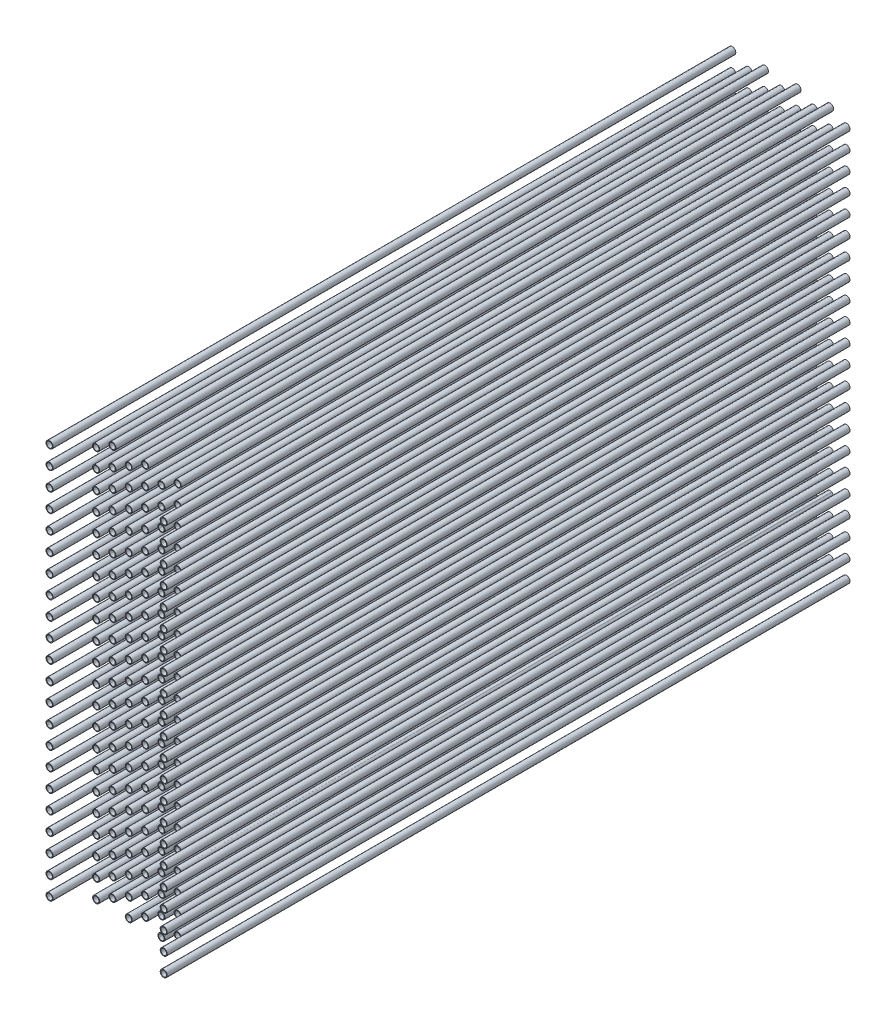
SolidWorks part; units mm, degrees
ref_plane "Alzado" through (0, 0, 0) normal (0, 0, 1) x (1, 0, 0)
ref_plane "Planta" through (0, 0, 0) normal (0, 1, 0) x (1, 0, 0)
ref_plane "Vista lateral" through (0, 0, 0) normal (1, 0, 0) x (0, 0, -1)
sketch "Croquis1" plane through (0, 0, 0) normal (0, 0, 1) x (1, 0, 0)
  line L0 (0, 0) -> (0, -25.4) construction
  line L1 (-22.225, 12.7) -> (-22.225, -12.7) construction
  line L2 (0, 0) -> (-44.45, 0) construction
  line L3 (0, 0) -> (0, -25.4) construction
  line L4 (-22.225, 12.7) -> (-66.675, 12.7) construction
  line L5 (-22.225, 12.7) -> (-22.225, -12.7) construction
  line L6 (-88.9, 0) -> (-88.9, -25.4) construction
  line L7 (-66.675, 12.7) -> (-111.125, 12.7) construction
  line L8 (-88.9, 0) -> (-133.35, 0) construction
  line L9 (-111.125, 12.7) -> (-155.575, 12.7) construction
  line L10 (-155.575, 12.7) -> (-155.575, -12.7) construction
  circle A0 centre (0, 0) radius 4.7625
  circle A1 centre (0, 0) radius 3.8625
  circle A2 centre (0, -25.4) radius 4.7625
  circle A3 centre (0, -25.4) radius 3.8625
  circle A4 centre (0, -50.8) radius 4.7625
  circle A5 centre (0, -50.8) radius 3.8625
  circle A6 centre (0, -76.2) radius 4.7625
  circle A7 centre (0, -76.2) radius 3.8625
  circle A8 centre (0, -101.6) radius 4.7625
  circle A9 centre (0, -101.6) radius 3.8625
  circle A10 centre (0, -127) radius 4.7625
  circle A11 centre (0, -127) radius 3.8625
  circle A12 centre (0, -152.4) radius 4.7625
  circle A13 centre (0, -152.4) radius 3.8625
  circle A14 centre (0, -177.8) radius 4.7625
  circle A15 centre (0, -177.8) radius 3.8625
  circle A16 centre (0, -203.2) radius 4.7625
  circle A17 centre (0, -203.2) radius 3.8625
  circle A18 centre (0, -228.6) radius 4.7625
  circle A19 centre (0, -228.6) radius 3.8625
  circle A20 centre (0, -254) radius 4.7625
  circle A21 centre (0, -254) radius 3.8625
  circle A22 centre (0, -279.4) radius 4.7625
  circle A23 centre (0, -279.4) radius 3.8625
  circle A24 centre (0, -304.8) radius 4.7625
  circle A25 centre (0, -304.8) radius 3.8625
  circle A26 centre (0, -330.2) radius 4.7625
  circle A27 centre (0, -330.2) radius 3.8625
  circle A28 centre (0, -355.6) radius 4.7625
  circle A29 centre (0, -355.6) radius 3.8625
  circle A30 centre (0, -381) radius 4.7625
  circle A31 centre (0, -381) radius 3.8625
  circle A32 centre (0, -406.4) radius 4.7625
  circle A33 centre (0, -406.4) radius 3.8625
  circle A34 centre (0, -431.8) radius 4.7625
  circle A35 centre (0, -431.8) radius 3.8625
  circle A36 centre (0, -457.2) radius 4.7625
  circle A37 centre (0, -457.2) radius 3.8625
  circle A38 centre (0, -482.6) radius 4.7625
  circle A39 centre (0, -482.6) radius 3.8625
  circle A40 centre (0, -508) radius 4.7625
  circle A41 centre (0, -508) radius 3.8625
  circle A42 centre (0, -533.4) radius 4.7625
  circle A43 centre (0, -533.4) radius 3.8625
  circle A44 centre (-22.225, 12.7) radius 4.7625
  circle A45 centre (-22.225, 12.7) radius 3.8625
  circle A46 centre (-22.225, -12.7) radius 4.7625
  circle A47 centre (-22.225, -12.7) radius 3.8625
  circle A48 centre (-22.225, -38.1) radius 4.7625
  circle A49 centre (-22.225, -38.1) radius 3.8625
  circle A50 centre (-22.225, -63.5) radius 4.7625
  circle A51 centre (-22.225, -63.5) radius 3.8625
  circle A52 centre (-22.225, -88.9) radius 4.7625
  circle A53 centre (-22.225, -88.9) radius 3.8625
  circle A54 centre (-22.225, -114.3) radius 4.7625
  circle A55 centre (-22.225, -114.3) radius 3.8625
  circle A56 centre (-22.225, -139.7) radius 4.7625
  circle A57 centre (-22.225, -139.7) radius 3.8625
  circle A58 centre (-22.225, -165.1) radius 4.7625
  circle A59 centre (-22.225, -165.1) radius 3.8625
  circle A60 centre (-22.225, -190.5) radius 4.7625
  circle A61 centre (-22.225, -190.5) radius 3.8625
  circle A62 centre (-22.225, -215.9) radius 4.7625
  circle A63 centre (-22.225, -215.9) radius 3.8625
  circle A64 centre (-22.225, -241.3) radius 4.7625
  circle A65 centre (-22.225, -241.3) radius 3.8625
  circle A66 centre (-22.225, -266.7) radius 4.7625
  circle A67 centre (-22.225, -266.7) radius 3.8625
  circle A68 centre (-22.225, -292.1) radius 4.7625
  circle A69 centre (-22.225, -292.1) radius 3.8625
  circle A70 centre (-22.225, -317.5) radius 4.7625
  circle A71 centre (-22.225, -317.5) radius 3.8625
  circle A72 centre (-22.225, -342.9) radius 4.7625
  circle A73 centre (-22.225, -342.9) radius 3.8625
  circle A74 centre (-22.225, -368.3) radius 4.7625
  circle A75 centre (-22.225, -368.3) radius 3.8625
  circle A76 centre (-22.225, -393.7) radius 4.7625
  circle A77 centre (-22.225, -393.7) radius 3.8625
  circle A78 centre (-22.225, -419.1) radius 4.7625
  circle A79 centre (-22.225, -419.1) radius 3.8625
  circle A80 centre (-22.225, -444.5) radius 4.7625
  circle A81 centre (-22.225, -444.5) radius 3.8625
  circle A82 centre (-22.225, -469.9) radius 4.7625
  circle A83 centre (-22.225, -469.9) radius 3.8625
  circle A84 centre (-22.225, -495.3) radius 4.7625
  circle A85 centre (-22.225, -495.3) radius 3.8625
  circle A86 centre (-22.225, -520.7) radius 4.7625
  circle A87 centre (-22.225, -520.7) radius 3.8625
  circle A88 centre (-44.45, 0) radius 4.7625
  circle A89 centre (-44.45, 0) radius 3.8625
  circle A90 centre (0, -25.4) radius 4.7625
  circle A91 centre (0, -25.4) radius 3.8625
  circle A92 centre (-44.45, -25.4) radius 4.7625
  circle A93 centre (-44.45, -25.4) radius 3.8625
  circle A94 centre (0, -50.8) radius 4.7625
  circle A95 centre (0, -50.8) radius 3.8625
  circle A96 centre (-44.45, -50.8) radius 4.7625
  circle A97 centre (-44.45, -50.8) radius 3.8625
  circle A98 centre (0, -76.2) radius 4.7625
  circle A99 centre (0, -76.2) radius 3.8625
  circle A100 centre (-44.45, -76.2) radius 4.7625
  circle A101 centre (-44.45, -76.2) radius 3.8625
  circle A102 centre (0, -101.6) radius 4.7625
  circle A103 centre (0, -101.6) radius 3.8625
  circle A104 centre (-44.45, -101.6) radius 4.7625
  circle A105 centre (-44.45, -101.6) radius 3.8625
  circle A106 centre (0, -127) radius 4.7625
  circle A107 centre (0, -127) radius 3.8625
  circle A108 centre (-44.45, -127) radius 4.7625
  circle A109 centre (-44.45, -127) radius 3.8625
  circle A110 centre (0, -152.4) radius 4.7625
  circle A111 centre (0, -152.4) radius 3.8625
  circle A112 centre (-44.45, -152.4) radius 4.7625
  circle A113 centre (-44.45, -152.4) radius 3.8625
  circle A114 centre (0, -177.8) radius 4.7625
  circle A115 centre (0, -177.8) radius 3.8625
  circle A116 centre (-44.45, -177.8) radius 4.7625
  circle A117 centre (-44.45, -177.8) radius 3.8625
  circle A118 centre (0, -203.2) radius 4.7625
  circle A119 centre (0, -203.2) radius 3.8625
  circle A120 centre (-44.45, -203.2) radius 4.7625
  circle A121 centre (-44.45, -203.2) radius 3.8625
  circle A122 centre (0, -228.6) radius 4.7625
  circle A123 centre (0, -228.6) radius 3.8625
  circle A124 centre (-44.45, -228.6) radius 4.7625
  circle A125 centre (-44.45, -228.6) radius 3.8625
  circle A126 centre (0, -254) radius 4.7625
  circle A127 centre (0, -254) radius 3.8625
  circle A128 centre (-44.45, -254) radius 4.7625
  circle A129 centre (-44.45, -254) radius 3.8625
  circle A130 centre (0, -279.4) radius 4.7625
  circle A131 centre (0, -279.4) radius 3.8625
  circle A132 centre (-44.45, -279.4) radius 4.7625
  circle A133 centre (-44.45, -279.4) radius 3.8625
  circle A134 centre (0, -304.8) radius 4.7625
  circle A135 centre (0, -304.8) radius 3.8625
  circle A136 centre (-44.45, -304.8) radius 4.7625
  circle A137 centre (-44.45, -304.8) radius 3.8625
  circle A138 centre (0, -330.2) radius 4.7625
  circle A139 centre (0, -330.2) radius 3.8625
  circle A140 centre (-44.45, -330.2) radius 4.7625
  circle A141 centre (-44.45, -330.2) radius 3.8625
  circle A142 centre (0, -355.6) radius 4.7625
  circle A143 centre (0, -355.6) radius 3.8625
  circle A144 centre (-44.45, -355.6) radius 4.7625
  circle A145 centre (-44.45, -355.6) radius 3.8625
  circle A146 centre (0, -381) radius 4.7625
  circle A147 centre (0, -381) radius 3.8625
  circle A148 centre (-44.45, -381) radius 4.7625
  circle A149 centre (-44.45, -381) radius 3.8625
  circle A150 centre (0, -406.4) radius 4.7625
  circle A151 centre (0, -406.4) radius 3.8625
  circle A152 centre (-44.45, -406.4) radius 4.7625
  circle A153 centre (-44.45, -406.4) radius 3.8625
  circle A154 centre (0, -431.8) radius 4.7625
  circle A155 centre (0, -431.8) radius 3.8625
  circle A156 centre (-44.45, -431.8) radius 4.7625
  circle A157 centre (-44.45, -431.8) radius 3.8625
  circle A158 centre (0, -457.2) radius 4.7625
  circle A159 centre (0, -457.2) radius 3.8625
  circle A160 centre (-44.45, -457.2) radius 4.7625
  circle A161 centre (-44.45, -457.2) radius 3.8625
  circle A162 centre (0, -482.6) radius 4.7625
  circle A163 centre (0, -482.6) radius 3.8625
  circle A164 centre (-44.45, -482.6) radius 4.7625
  circle A165 centre (-44.45, -482.6) radius 3.8625
  circle A166 centre (0, -508) radius 4.7625
  circle A167 centre (0, -508) radius 3.8625
  circle A168 centre (-44.45, -508) radius 4.7625
  circle A169 centre (-44.45, -508) radius 3.8625
  circle A170 centre (0, -533.4) radius 4.7625
  circle A171 centre (0, -533.4) radius 3.8625
  circle A172 centre (-44.45, -533.4) radius 4.7625
  circle A173 centre (-44.45, -533.4) radius 3.8625
  circle A174 centre (-66.675, 12.7) radius 4.7625
  circle A175 centre (-66.675, 12.7) radius 3.8625
  circle A176 centre (-22.225, -12.7) radius 4.7625
  circle A177 centre (-22.225, -12.7) radius 3.8625
  circle A178 centre (-66.675, -12.7) radius 4.7625
  circle A179 centre (-66.675, -12.7) radius 3.8625
  circle A180 centre (-22.225, -38.1) radius 4.7625
  circle A181 centre (-22.225, -38.1) radius 3.8625
  circle A182 centre (-66.675, -38.1) radius 4.7625
  circle A183 centre (-66.675, -38.1) radius 3.8625
  circle A184 centre (-22.225, -63.5) radius 4.7625
  circle A185 centre (-22.225, -63.5) radius 3.8625
  circle A186 centre (-66.675, -63.5) radius 4.7625
  circle A187 centre (-66.675, -63.5) radius 3.8625
  circle A188 centre (-22.225, -88.9) radius 4.7625
  circle A189 centre (-22.225, -88.9) radius 3.8625
  circle A190 centre (-66.675, -88.9) radius 4.7625
  circle A191 centre (-66.675, -88.9) radius 3.8625
  circle A192 centre (-22.225, -114.3) radius 4.7625
  circle A193 centre (-22.225, -114.3) radius 3.8625
  circle A194 centre (-66.675, -114.3) radius 4.7625
  circle A195 centre (-66.675, -114.3) radius 3.8625
  circle A196 centre (-22.225, -139.7) radius 4.7625
  circle A197 centre (-22.225, -139.7) radius 3.8625
  circle A198 centre (-66.675, -139.7) radius 4.7625
  circle A199 centre (-66.675, -139.7) radius 3.8625
  circle A200 centre (-22.225, -165.1) radius 4.7625
  circle A201 centre (-22.225, -165.1) radius 3.8625
  circle A202 centre (-66.675, -165.1) radius 4.7625
  circle A203 centre (-66.675, -165.1) radius 3.8625
  circle A204 centre (-22.225, -190.5) radius 4.7625
  circle A205 centre (-22.225, -190.5) radius 3.8625
  circle A206 centre (-66.675, -190.5) radius 4.7625
  circle A207 centre (-66.675, -190.5) radius 3.8625
  circle A208 centre (-22.225, -215.9) radius 4.7625
  circle A209 centre (-22.225, -215.9) radius 3.8625
  circle A210 centre (-66.675, -215.9) radius 4.7625
  circle A211 centre (-66.675, -215.9) radius 3.8625
  circle A212 centre (-22.225, -241.3) radius 4.7625
  circle A213 centre (-22.225, -241.3) radius 3.8625
  circle A214 centre (-66.675, -241.3) radius 4.7625
  circle A215 centre (-66.675, -241.3) radius 3.8625
  circle A216 centre (-22.225, -266.7) radius 4.7625
  circle A217 centre (-22.225, -266.7) radius 3.8625
  circle A218 centre (-66.675, -266.7) radius 4.7625
  circle A219 centre (-66.675, -266.7) radius 3.8625
  circle A220 centre (-22.225, -292.1) radius 4.7625
  circle A221 centre (-22.225, -292.1) radius 3.8625
  circle A222 centre (-66.675, -292.1) radius 4.7625
  circle A223 centre (-66.675, -292.1) radius 3.8625
  circle A224 centre (-22.225, -317.5) radius 4.7625
  circle A225 centre (-22.225, -317.5) radius 3.8625
  circle A226 centre (-66.675, -317.5) radius 4.7625
  circle A227 centre (-66.675, -317.5) radius 3.8625
  circle A228 centre (-22.225, -342.9) radius 4.7625
  circle A229 centre (-22.225, -342.9) radius 3.8625
  circle A230 centre (-66.675, -342.9) radius 4.7625
  circle A231 centre (-66.675, -342.9) radius 3.8625
  circle A232 centre (-22.225, -368.3) radius 4.7625
  circle A233 centre (-22.225, -368.3) radius 3.8625
  circle A234 centre (-66.675, -368.3) radius 4.7625
  circle A235 centre (-66.675, -368.3) radius 3.8625
  circle A236 centre (-22.225, -393.7) radius 4.7625
  circle A237 centre (-22.225, -393.7) radius 3.8625
  circle A238 centre (-66.675, -393.7) radius 4.7625
  circle A239 centre (-66.675, -393.7) radius 3.8625
  circle A240 centre (-22.225, -419.1) radius 4.7625
  circle A241 centre (-22.225, -419.1) radius 3.8625
  circle A242 centre (-66.675, -419.1) radius 4.7625
  circle A243 centre (-66.675, -419.1) radius 3.8625
  circle A244 centre (-22.225, -444.5) radius 4.7625
  circle A245 centre (-22.225, -444.5) radius 3.8625
  circle A246 centre (-66.675, -444.5) radius 4.7625
  circle A247 centre (-66.675, -444.5) radius 3.8625
  circle A248 centre (-22.225, -469.9) radius 4.7625
  circle A249 centre (-22.225, -469.9) radius 3.8625
  circle A250 centre (-66.675, -469.9) radius 4.7625
  circle A251 centre (-66.675, -469.9) radius 3.8625
  circle A252 centre (-22.225, -495.3) radius 4.7625
  circle A253 centre (-22.225, -495.3) radius 3.8625
  circle A254 centre (-66.675, -495.3) radius 4.7625
  circle A255 centre (-66.675, -495.3) radius 3.8625
  circle A256 centre (-22.225, -520.7) radius 4.7625
  circle A257 centre (-22.225, -520.7) radius 3.8625
  circle A258 centre (-66.675, -520.7) radius 4.7625
  circle A259 centre (-66.675, -520.7) radius 3.8625
  circle A260 centre (-88.9, 0) radius 4.7625
  circle A261 centre (-88.9, 0) radius 3.8625
  circle A262 centre (-88.9, -25.4) radius 4.7625
  circle A263 centre (-88.9, -25.4) radius 3.8625
  circle A264 centre (-88.9, -50.8) radius 4.7625
  circle A265 centre (-88.9, -50.8) radius 3.8625
  circle A266 centre (-88.9, -76.2) radius 4.7625
  circle A267 centre (-88.9, -76.2) radius 3.8625
  circle A268 centre (-88.9, -101.6) radius 4.7625
  circle A269 centre (-88.9, -101.6) radius 3.8625
  circle A270 centre (-88.9, -127) radius 4.7625
  circle A271 centre (-88.9, -127) radius 3.8625
  circle A272 centre (-88.9, -152.4) radius 4.7625
  circle A273 centre (-88.9, -152.4) radius 3.8625
  circle A274 centre (-88.9, -177.8) radius 4.7625
  circle A275 centre (-88.9, -177.8) radius 3.8625
  circle A276 centre (-88.9, -203.2) radius 4.7625
  circle A277 centre (-88.9, -203.2) radius 3.8625
  circle A278 centre (-88.9, -228.6) radius 4.7625
  circle A279 centre (-88.9, -228.6) radius 3.8625
  circle A280 centre (-88.9, -254) radius 4.7625
  circle A281 centre (-88.9, -254) radius 3.8625
  circle A282 centre (-88.9, -279.4) radius 4.7625
  circle A283 centre (-88.9, -279.4) radius 3.8625
  circle A284 centre (-88.9, -304.8) radius 4.7625
  circle A285 centre (-88.9, -304.8) radius 3.8625
  circle A286 centre (-88.9, -330.2) radius 4.7625
  circle A287 centre (-88.9, -330.2) radius 3.8625
  circle A288 centre (-88.9, -355.6) radius 4.7625
  circle A289 centre (-88.9, -355.6) radius 3.8625
  circle A290 centre (-88.9, -381) radius 4.7625
  circle A291 centre (-88.9, -381) radius 3.8625
  circle A292 centre (-88.9, -406.4) radius 4.7625
  circle A293 centre (-88.9, -406.4) radius 3.8625
  circle A294 centre (-88.9, -431.8) radius 4.7625
  circle A295 centre (-88.9, -431.8) radius 3.8625
  circle A296 centre (-88.9, -457.2) radius 4.7625
  circle A297 centre (-88.9, -457.2) radius 3.8625
  circle A298 centre (-88.9, -482.6) radius 4.7625
  circle A299 centre (-88.9, -482.6) radius 3.8625
  circle A300 centre (-88.9, -508) radius 4.7625
  circle A301 centre (-88.9, -508) radius 3.8625
  circle A302 centre (-88.9, -533.4) radius 4.7625
  circle A303 centre (-88.9, -533.4) radius 3.8625
  circle A304 centre (-111.125, 12.7) radius 4.7625
  circle A305 centre (-111.125, 12.7) radius 3.8625
  circle A306 centre (-111.125, -12.7) radius 4.7625
  circle A307 centre (-111.125, -12.7) radius 3.8625
  circle A308 centre (-111.125, -38.1) radius 4.7625
  circle A309 centre (-111.125, -38.1) radius 3.8625
  circle A310 centre (-111.125, -63.5) radius 4.7625
  circle A311 centre (-111.125, -63.5) radius 3.8625
  circle A312 centre (-111.125, -88.9) radius 4.7625
  circle A313 centre (-111.125, -88.9) radius 3.8625
  circle A314 centre (-111.125, -114.3) radius 4.7625
  circle A315 centre (-111.125, -114.3) radius 3.8625
  circle A316 centre (-111.125, -139.7) radius 4.7625
  circle A317 centre (-111.125, -139.7) radius 3.8625
  circle A318 centre (-111.125, -165.1) radius 4.7625
  circle A319 centre (-111.125, -165.1) radius 3.8625
  circle A320 centre (-111.125, -190.5) radius 4.7625
  circle A321 centre (-111.125, -190.5) radius 3.8625
  circle A322 centre (-111.125, -215.9) radius 4.7625
  circle A323 centre (-111.125, -215.9) radius 3.8625
  circle A324 centre (-111.125, -241.3) radius 4.7625
  circle A325 centre (-111.125, -241.3) radius 3.8625
  circle A326 centre (-111.125, -266.7) radius 4.7625
  circle A327 centre (-111.125, -266.7) radius 3.8625
  circle A328 centre (-111.125, -292.1) radius 4.7625
  circle A329 centre (-111.125, -292.1) radius 3.8625
  circle A330 centre (-111.125, -317.5) radius 4.7625
  circle A331 centre (-111.125, -317.5) radius 3.8625
  circle A332 centre (-111.125, -342.9) radius 4.7625
  circle A333 centre (-111.125, -342.9) radius 3.8625
  circle A334 centre (-111.125, -368.3) radius 4.7625
  circle A335 centre (-111.125, -368.3) radius 3.8625
  circle A336 centre (-111.125, -393.7) radius 4.7625
  circle A337 centre (-111.125, -393.7) radius 3.8625
  circle A338 centre (-111.125, -419.1) radius 4.7625
  circle A339 centre (-111.125, -419.1) radius 3.8625
  circle A340 centre (-111.125, -444.5) radius 4.7625
  circle A341 centre (-111.125, -444.5) radius 3.8625
  circle A342 centre (-111.125, -469.9) radius 4.7625
  circle A343 centre (-111.125, -469.9) radius 3.8625
  circle A344 centre (-111.125, -495.3) radius 4.7625
  circle A345 centre (-111.125, -495.3) radius 3.8625
  circle A346 centre (-111.125, -520.7) radius 4.7625
  circle A347 centre (-111.125, -520.7) radius 3.8625
  circle A348 centre (-133.35, 0) radius 4.7625
  circle A349 centre (-133.35, 0) radius 3.8625
  circle A350 centre (-133.35, -25.4) radius 4.7625
  circle A351 centre (-133.35, -25.4) radius 3.8625
  circle A352 centre (-133.35, -50.8) radius 4.7625
  circle A353 centre (-133.35, -50.8) radius 3.8625
  circle A354 centre (-133.35, -76.2) radius 4.7625
  circle A355 centre (-133.35, -76.2) radius 3.8625
  circle A356 centre (-133.35, -101.6) radius 4.7625
  circle A357 centre (-133.35, -101.6) radius 3.8625
  circle A358 centre (-133.35, -127) radius 4.7625
  circle A359 centre (-133.35, -127) radius 3.8625
  circle A360 centre (-133.35, -152.4) radius 4.7625
  circle A361 centre (-133.35, -152.4) radius 3.8625
  circle A362 centre (-133.35, -177.8) radius 4.7625
  circle A363 centre (-133.35, -177.8) radius 3.8625
  circle A364 centre (-133.35, -203.2) radius 4.7625
  circle A365 centre (-133.35, -203.2) radius 3.8625
  circle A366 centre (-133.35, -228.6) radius 4.7625
  circle A367 centre (-133.35, -228.6) radius 3.8625
  circle A368 centre (-133.35, -254) radius 4.7625
  circle A369 centre (-133.35, -254) radius 3.8625
  circle A370 centre (-133.35, -279.4) radius 4.7625
  circle A371 centre (-133.35, -279.4) radius 3.8625
  circle A372 centre (-133.35, -304.8) radius 4.7625
  circle A373 centre (-133.35, -304.8) radius 3.8625
  circle A374 centre (-133.35, -330.2) radius 4.7625
  circle A375 centre (-133.35, -330.2) radius 3.8625
  circle A376 centre (-133.35, -355.6) radius 4.7625
  circle A377 centre (-133.35, -355.6) radius 3.8625
  circle A378 centre (-133.35, -381) radius 4.7625
  circle A379 centre (-133.35, -381) radius 3.8625
  circle A380 centre (-133.35, -406.4) radius 4.7625
  circle A381 centre (-133.35, -406.4) radius 3.8625
  circle A382 centre (-133.35, -431.8) radius 4.7625
  circle A383 centre (-133.35, -431.8) radius 3.8625
  circle A384 centre (-133.35, -457.2) radius 4.7625
  circle A385 centre (-133.35, -457.2) radius 3.8625
  circle A386 centre (-133.35, -482.6) radius 4.7625
  circle A387 centre (-133.35, -482.6) radius 3.8625
  circle A388 centre (-133.35, -508) radius 4.7625
  circle A389 centre (-133.35, -508) radius 3.8625
  circle A390 centre (-133.35, -533.4) radius 4.7625
  circle A391 centre (-133.35, -533.4) radius 3.8625
  circle A392 centre (-155.575, 12.7) radius 4.7625
  circle A393 centre (-155.575, 12.7) radius 3.8625
  circle A394 centre (-155.575, -12.7) radius 4.7625
  circle A395 centre (-155.575, -12.7) radius 3.8625
  circle A396 centre (-155.575, -38.1) radius 4.7625
  circle A397 centre (-155.575, -38.1) radius 3.8625
  circle A398 centre (-155.575, -63.5) radius 4.7625
  circle A399 centre (-155.575, -63.5) radius 3.8625
  circle A400 centre (-155.575, -88.9) radius 4.7625
  circle A401 centre (-155.575, -88.9) radius 3.8625
  circle A402 centre (-155.575, -114.3) radius 4.7625
  circle A403 centre (-155.575, -114.3) radius 3.8625
  circle A404 centre (-155.575, -139.7) radius 4.7625
  circle A405 centre (-155.575, -139.7) radius 3.8625
  circle A406 centre (-155.575, -165.1) radius 4.7625
  circle A407 centre (-155.575, -165.1) radius 3.8625
  circle A408 centre (-155.575, -190.5) radius 4.7625
  circle A409 centre (-155.575, -190.5) radius 3.8625
  circle A410 centre (-155.575, -215.9) radius 4.7625
  circle A411 centre (-155.575, -215.9) radius 3.8625
  circle A412 centre (-155.575, -241.3) radius 4.7625
  circle A413 centre (-155.575, -241.3) radius 3.8625
  circle A414 centre (-155.575, -266.7) radius 4.7625
  circle A415 centre (-155.575, -266.7) radius 3.8625
  circle A416 centre (-155.575, -292.1) radius 4.7625
  circle A417 centre (-155.575, -292.1) radius 3.8625
  circle A418 centre (-155.575, -317.5) radius 4.7625
  circle A419 centre (-155.575, -317.5) radius 3.8625
  circle A420 centre (-155.575, -342.9) radius 4.7625
  circle A421 centre (-155.575, -342.9) radius 3.8625
  circle A422 centre (-155.575, -368.3) radius 4.7625
  circle A423 centre (-155.575, -368.3) radius 3.8625
  circle A424 centre (-155.575, -393.7) radius 4.7625
  circle A425 centre (-155.575, -393.7) radius 3.8625
  circle A426 centre (-155.575, -419.1) radius 4.7625
  circle A427 centre (-155.575, -419.1) radius 3.8625
  circle A428 centre (-155.575, -444.5) radius 4.7625
  circle A429 centre (-155.575, -444.5) radius 3.8625
  circle A430 centre (-155.575, -469.9) radius 4.7625
  circle A431 centre (-155.575, -469.9) radius 3.8625
  circle A432 centre (-155.575, -495.3) radius 4.7625
  circle A433 centre (-155.575, -495.3) radius 3.8625
  circle A434 centre (-155.575, -520.7) radius 4.7625
  circle A435 centre (-155.575, -520.7) radius 3.8625
  dimension "D1" = 9.525
  dimension "D2" = 7.725
  dimension "D7" = 9.525
  dimension "D8" = 7.725
  dimension "D4" = 25.4
  dimension "D5" = 12.7
  dimension "D6" = 22.225
  dimension "D10" = 25.4
  dimension "D12" = 44.45
  dimension "D14" = 25.4
  dimension "D16" = 44.45
  dimension "D18" = 25.4
  dimension "D21" = 25.4
  dimension "D23" = 44.45
  dimension "D26" = 44.45
  dimension "D29" = 44.45
  dimension "D31" = 25.4
  dimension "D3" = 22
  dimension "D9" = 22
  dimension "D11" = 2
  dimension "D13" = 22
  dimension "D15" = 2
  dimension "D17" = 22
  dimension "D19" = 2
  dimension "D20" = 22
  dimension "D22" = 2
  dimension "D24" = 22
  dimension "D25" = 2
  dimension "D27" = 22
  dimension "D28" = 2
  dimension "D30" = 22
extrude "Saliente-Extruir1" add sketch "Croquis1" against normal blind 889
sketch "Croquis2" plane through (0, 0, 0) normal (0, 0, 1) x (1, 0, 0)
  circle A0 centre (-155.575, -520.7) radius 3.8625 construction
  circle A1 centre (-155.575, -520.7) radius 4.7625 construction
  circle A2 centre (-155.575, -520.7) radius 3.8625
  circle A3 centre (-155.575, -520.7) radius 4.7625
extrude "Saliente-Extruir2" add sketch "Croquis2" along normal blind 41.275
sketch "Croquis3" plane through (0, 0, 0) normal (0, 0, 1) x (1, 0, 0)
  circle A0 centre (-155.575, -495.3) radius 3.8625 construction
  circle A1 centre (-155.575, -495.3) radius 4.7625 construction
  circle A2 centre (-155.575, -469.9) radius 3.8625 construction
  circle A3 centre (-155.575, -469.9) radius 4.7625 construction
  circle A4 centre (-155.575, -444.5) radius 3.8625 construction
  circle A5 centre (-155.575, -444.5) radius 4.7625 construction
  circle A6 centre (-155.575, -419.1) radius 3.8625 construction
  circle A7 centre (-155.575, -419.1) radius 4.7625 construction
  circle A8 centre (-155.575, -393.7) radius 3.8625 construction
  circle A9 centre (-155.575, -393.7) radius 4.7625 construction
  circle A10 centre (-155.575, -368.3) radius 3.8625 construction
  circle A11 centre (-155.575, -368.3) radius 4.7625 construction
  circle A12 centre (-155.575, -342.9) radius 3.8625 construction
  circle A13 centre (-155.575, -342.9) radius 4.7625 construction
  circle A14 centre (-155.575, -317.5) radius 3.8625 construction
  circle A15 centre (-155.575, -317.5) radius 4.7625 construction
  circle A16 centre (-155.575, -292.1) radius 3.8625 construction
  circle A17 centre (-155.575, -292.1) radius 4.7625 construction
  circle A18 centre (-155.575, -266.7) radius 3.8625 construction
  circle A19 centre (-155.575, -266.7) radius 4.7625 construction
  circle A20 centre (-155.575, -241.3) radius 3.8625 construction
  circle A21 centre (-155.575, -241.3) radius 4.7625 construction
  circle A22 centre (-155.575, -215.9) radius 3.8625 construction
  circle A23 centre (-155.575, -215.9) radius 4.7625 construction
  circle A24 centre (-155.575, -190.5) radius 3.8625 construction
  circle A25 centre (-155.575, -190.5) radius 4.7625 construction
  circle A26 centre (-155.575, -165.1) radius 3.8625 construction
  circle A27 centre (-155.575, -165.1) radius 4.7625 construction
  circle A28 centre (-155.575, -139.7) radius 3.8625 construction
  circle A29 centre (-155.575, -139.7) radius 4.7625 construction
  circle A30 centre (-155.575, -114.3) radius 3.8625 construction
  circle A31 centre (-155.575, -114.3) radius 4.7625 construction
  circle A32 centre (-155.575, -88.9) radius 3.8625 construction
  circle A33 centre (-155.575, -88.9) radius 4.7625 construction
  circle A34 centre (-155.575, -63.5) radius 3.8625 construction
  circle A35 centre (-155.575, -63.5) radius 4.7625 construction
  circle A36 centre (-155.575, -38.1) radius 3.8625 construction
  circle A37 centre (-155.575, -38.1) radius 4.7625 construction
  circle A38 centre (-155.575, -12.7) radius 3.8625 construction
  circle A39 centre (-155.575, -12.7) radius 4.7625 construction
  circle A40 centre (-155.575, 12.7) radius 3.8625 construction
  circle A41 centre (-155.575, 12.7) radius 4.7625 construction
  circle A42 centre (-155.575, -495.3) radius 3.8625
  circle A43 centre (-155.575, -495.3) radius 4.7625
  circle A44 centre (-155.575, -469.9) radius 3.8625
  circle A45 centre (-155.575, -469.9) radius 4.7625
  circle A46 centre (-155.575, -444.5) radius 3.8625
  circle A47 centre (-155.575, -444.5) radius 4.7625
  circle A48 centre (-155.575, -419.1) radius 3.8625
  circle A49 centre (-155.575, -419.1) radius 4.7625
  circle A50 centre (-155.575, -393.7) radius 3.8625
  circle A51 centre (-155.575, -393.7) radius 4.7625
  circle A52 centre (-155.575, -368.3) radius 3.8625
  circle A53 centre (-155.575, -368.3) radius 4.7625
  circle A54 centre (-155.575, -342.9) radius 3.8625
  circle A55 centre (-155.575, -342.9) radius 4.7625
  circle A56 centre (-155.575, -317.5) radius 3.8625
  circle A57 centre (-155.575, -317.5) radius 4.7625
  circle A58 centre (-155.575, -292.1) radius 3.8625
  circle A59 centre (-155.575, -292.1) radius 4.7625
  circle A60 centre (-155.575, -266.7) radius 3.8625
  circle A61 centre (-155.575, -266.7) radius 4.7625
  circle A62 centre (-155.575, -241.3) radius 3.8625
  circle A63 centre (-155.575, -241.3) radius 4.7625
  circle A64 centre (-155.575, -215.9) radius 3.8625
  circle A65 centre (-155.575, -215.9) radius 4.7625
  circle A66 centre (-155.575, -190.5) radius 3.8625
  circle A67 centre (-155.575, -190.5) radius 4.7625
  circle A68 centre (-155.575, -165.1) radius 3.8625
  circle A69 centre (-155.575, -165.1) radius 4.7625
  circle A70 centre (-155.575, -139.7) radius 3.8625
  circle A71 centre (-155.575, -139.7) radius 4.7625
  circle A72 centre (-155.575, -114.3) radius 3.8625
  circle A73 centre (-155.575, -114.3) radius 4.7625
  circle A74 centre (-155.575, -88.9) radius 3.8625
  circle A75 centre (-155.575, -88.9) radius 4.7625
  circle A76 centre (-155.575, -63.5) radius 3.8625
  circle A77 centre (-155.575, -63.5) radius 4.7625
  circle A78 centre (-155.575, -38.1) radius 3.8625
  circle A79 centre (-155.575, -38.1) radius 4.7625
  circle A80 centre (-155.575, -12.7) radius 3.8625
  circle A81 centre (-155.575, -12.7) radius 4.7625
  circle A82 centre (-155.575, 12.7) radius 3.8625
  circle A83 centre (-155.575, 12.7) radius 4.7625
extrude "Saliente-Extruir3" add sketch "Croquis3" along normal blind 41.275
sketch "Croquis6" plane through (0, 0, 0) normal (0, 0, 1) x (1, 0, 0)
  circle A0 centre (-22.225, -520.7) radius 3.8625
  circle A1 centre (-22.225, -495.3) radius 3.8625
  circle A2 centre (-22.225, -469.9) radius 3.8625
  circle A3 centre (-22.225, -444.5) radius 3.8625
  circle A4 centre (-22.225, -419.1) radius 3.8625
  circle A5 centre (-22.225, -393.7) radius 3.8625
  circle A6 centre (-22.225, -368.3) radius 3.8625
  circle A7 centre (-22.225, -342.9) radius 3.8625
  circle A8 centre (-22.225, -317.5) radius 3.8625
  circle A9 centre (-22.225, -292.1) radius 3.8625
  circle A10 centre (-22.225, -266.7) radius 3.8625
  circle A11 centre (-22.225, -241.3) radius 3.8625
  circle A12 centre (-22.225, -215.9) radius 3.8625
  circle A13 centre (-22.225, -190.5) radius 3.8625
  circle A14 centre (-22.225, -165.1) radius 3.8625
  circle A15 centre (-22.225, -139.7) radius 3.8625
  circle A16 centre (-22.225, -114.3) radius 3.8625
  circle A17 centre (-22.225, -88.9) radius 3.8625
  circle A18 centre (-22.225, -63.5) radius 3.8625
  circle A19 centre (-22.225, -38.1) radius 3.8625
  circle A20 centre (-22.225, -12.7) radius 3.8625
  circle A21 centre (-22.225, 12.7) radius 3.8625
  dimension "D1" = 7.725
  dimension "D2" = 22
extrude "Cortar-Extruir2" cut sketch "Croquis6" against normal up to next
sketch "Croquis7" plane through (0, 0, 0) normal (0, 0, 1) x (1, 0, 0)
  circle A0 centre (0, -533.4) radius 4.7625 construction
  circle A1 centre (0, -508) radius 4.7625 construction
  circle A2 centre (0, -482.6) radius 4.7625 construction
  circle A3 centre (0, -457.2) radius 4.7625 construction
  circle A4 centre (0, -431.8) radius 4.7625 construction
  circle A5 centre (0, -406.4) radius 4.7625 construction
  circle A6 centre (0, -381) radius 4.7625 construction
  circle A7 centre (0, -355.6) radius 4.7625 construction
  circle A8 centre (0, -330.2) radius 4.7625 construction
  circle A9 centre (0, -304.8) radius 4.7625 construction
  circle A10 centre (0, -279.4) radius 4.7625 construction
  circle A11 centre (0, -254) radius 4.7625 construction
  circle A12 centre (0, -228.6) radius 4.7625 construction
  circle A13 centre (0, -203.2) radius 4.7625 construction
  circle A14 centre (0, -177.8) radius 4.7625 construction
  circle A15 centre (0, -152.4) radius 4.7625 construction
  circle A16 centre (0, -127) radius 4.7625 construction
  circle A17 centre (0, -101.6) radius 4.7625 construction
  circle A18 centre (0, -76.2) radius 4.7625 construction
  circle A19 centre (0, -50.8) radius 4.7625 construction
  circle A20 centre (0, -25.4) radius 4.7625 construction
  circle A21 centre (0, 0) radius 4.7625 construction
  circle A22 centre (0, -533.4) radius 4.7625
  circle A23 centre (0, -508) radius 4.7625
  circle A24 centre (0, -482.6) radius 4.7625
  circle A25 centre (0, -457.2) radius 4.7625
  circle A26 centre (0, -431.8) radius 4.7625
  circle A27 centre (0, -406.4) radius 4.7625
  circle A28 centre (0, -381) radius 4.7625
  circle A29 centre (0, -355.6) radius 4.7625
  circle A30 centre (0, -330.2) radius 4.7625
  circle A31 centre (0, -304.8) radius 4.7625
  circle A32 centre (0, -279.4) radius 4.7625
  circle A33 centre (0, -254) radius 4.7625
  circle A34 centre (0, -228.6) radius 4.7625
  circle A35 centre (0, -203.2) radius 4.7625
  circle A36 centre (0, -177.8) radius 4.7625
  circle A37 centre (0, -152.4) radius 4.7625
  circle A38 centre (0, -127) radius 4.7625
  circle A39 centre (0, -101.6) radius 4.7625
  circle A40 centre (0, -76.2) radius 4.7625
  circle A41 centre (0, -50.8) radius 4.7625
  circle A42 centre (0, -25.4) radius 4.7625
  circle A43 centre (0, 0) radius 4.7625
extrude "Saliente-Extruir4" add sketch "Croquis7" along normal blind 41.275
sketch "Croquis8" plane through (0, 0, 41.275) normal (0, 0, 1) x (1, 0, 0)
  circle A0 centre (0, -533.4) radius 3.8625
  circle A1 centre (0, -508) radius 3.8625
  circle A2 centre (0, -482.6) radius 3.8625
  circle A3 centre (0, -457.2) radius 3.8625
  circle A4 centre (0, -431.8) radius 3.8625
  circle A5 centre (0, -406.4) radius 3.8625
  circle A6 centre (0, -381) radius 3.8625
  circle A7 centre (0, -355.6) radius 3.8625
  circle A8 centre (0, -330.2) radius 3.8625
  circle A9 centre (0, -304.8) radius 3.8625
  circle A10 centre (0, -279.4) radius 3.8625
  circle A11 centre (0, -254) radius 3.8625
  circle A12 centre (0, -228.6) radius 3.8625
  circle A13 centre (0, -203.2) radius 3.8625
  circle A14 centre (0, -177.8) radius 3.8625
  circle A15 centre (0, -152.4) radius 3.8625
  circle A16 centre (0, -127) radius 3.8625
  circle A17 centre (0, -101.6) radius 3.8625
  circle A18 centre (0, -76.2) radius 3.8625
  circle A19 centre (0, -50.8) radius 3.8625
  circle A20 centre (0, -25.4) radius 3.8625
  circle A21 centre (0, 0) radius 3.8625
  dimension "D1" = 7.725
  dimension "D2" = 22
extrude "Cortar-Extruir4" cut sketch "Croquis8" against normal up to next
